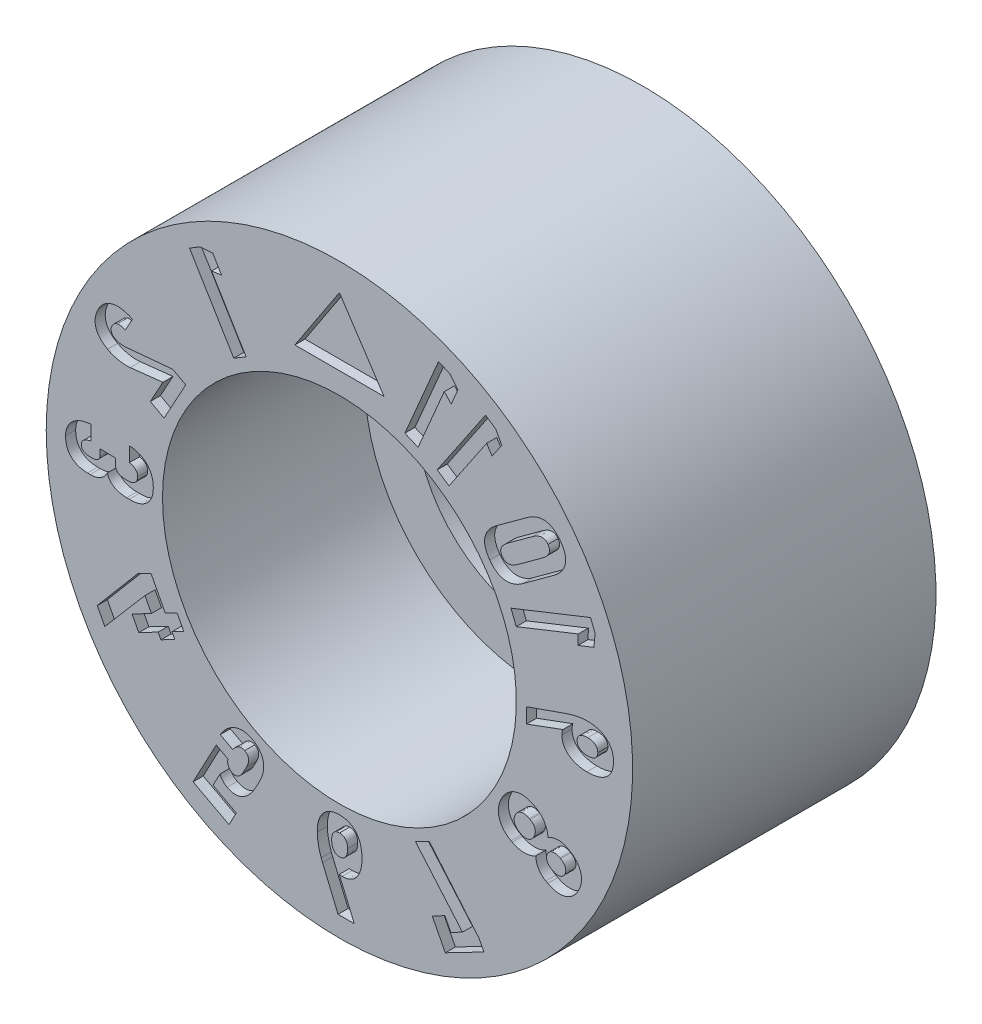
SolidWorks part; units mm, degrees
ref_plane "Front Plane" through (0, 0, 0) normal (0, 0, 1) x (1, 0, 0)
ref_plane "Top Plane" through (0, 0, 0) normal (0, 1, 0) x (1, 0, 0)
ref_plane "Right Plane" through (0, 0, 0) normal (1, 0, 0) x (0, 0, -1)
imported_body "Imported1"
other "Move Face2" parameters "D1"=0.157
other "DeleteFace1"
sketch "Sketch1" plane through (0, 0, 0) normal (0, 0, 1) x (1, 0, 0)
  line L0 (0, 0) -> (3.181, 1.8365) construction
  line L1 (0, 0) -> (3.6731, 0) construction
  line L2 (0, -1.65) -> (0, 1.65) construction
  line L3 (0, 0) -> (3.181, -1.8365) construction
  line L4 (0, 0) -> (1.8365, -3.181) construction
  line L5 (0, 0) -> (0, -3.6731) construction
  line L6 (0, 0) -> (-1.8365, -3.181) construction
  line L7 (0, 0) -> (-3.181, -1.8365) construction
  line L8 (0, 0) -> (-3.6731, 0) construction
  line L9 (0, 0) -> (-3.181, 1.8365) construction
  line L10 (0, 0) -> (-1.8365, 3.181) construction
  line L11 (0, 0) -> (0, 3.6731) construction
  line L12 (0, 0) -> (1.8365, 3.181) construction
  line L13 (1.6966, 0.7755) -> (1.7491, 0.6435)
  line L14 (1.7491, 0.6435) -> (2.362, 0.8873)
  line L15 (2.362, 0.8873) -> (2.3596, 0.7877)
  line L16 (2.3596, 0.7877) -> (2.5172, 0.8505)
  line L17 (2.5172, 0.8505) -> (2.5287, 0.976)
  line L18 (2.5287, 0.976) -> (2.4838, 1.0888)
  line L19 (2.4838, 1.0888) -> (1.6966, 0.7755)
  line L20 (1.8134, 1.0443) -> (2.1244, 1.2716)
  line L21 (1.8597, 1.6338) -> (1.5486, 1.4066)
  line L22 (1.665, 1.3166) -> (1.9102, 1.4958)
  line L23 (2.0082, 1.3617) -> (1.763, 1.1824)
  line L24 (0.9667, 1.5952) -> (1.0838, 1.5162)
  line L25 (1.0838, 1.5162) -> (1.4562, 2.0674)
  line L26 (1.4562, 2.0674) -> (1.5097, 1.9837)
  line L27 (1.5097, 1.9837) -> (1.6055, 2.1254)
  line L28 (1.6055, 2.1254) -> (1.545, 2.2357)
  line L29 (1.545, 2.2357) -> (1.445, 2.3031)
  line L30 (1.445, 2.3031) -> (0.9667, 1.5952)
  line L31 (0.6471, 1.7495) -> (0.7777, 1.6937)
  line L32 (0.7777, 1.6937) -> (1.0369, 2.3006)
  line L33 (1.0369, 2.3006) -> (1.1059, 2.2287)
  line L34 (1.1059, 2.2287) -> (1.1724, 2.3847)
  line L35 (1.1724, 2.3847) -> (1.0916, 2.4814)
  line L36 (1.0916, 2.4814) -> (0.98, 2.5291)
  line L37 (0.98, 2.5291) -> (0.6471, 1.7495)
  line L38 (-1.0449, 1.5455) -> (-0.9232, 1.6191)
  line L39 (-0.9232, 1.6191) -> (-1.2643, 2.1831)
  line L40 (-1.2643, 2.1831) -> (-1.1654, 2.1972)
  line L41 (-1.1654, 2.1972) -> (-1.253, 2.3423)
  line L42 (-1.253, 2.3423) -> (-1.3789, 2.3327)
  line L43 (-1.3789, 2.3327) -> (-1.4828, 2.2699)
  line L44 (-1.4828, 2.2699) -> (-1.0449, 1.5455)
  line L45 (-1.647, 1.149) -> (-2.109, 1.1071)
  line L46 (-2.2179, 1.1246) -> (-2.2189, 1.1252)
  line L47 (-2.1176, 1.2513) -> (-2.1171, 1.2511)
  line L48 (-2.1171, 1.2511) -> (-2.047, 1.3791)
  line L49 (-2.047, 1.3791) -> (-2.0475, 1.3793)
  line L50 (-2.2933, 0.9992) -> (-2.2929, 0.9988)
  line L51 (-2.0682, 0.9533) -> (-1.7463, 0.9887)
  line L52 (-1.7463, 0.9887) -> (-1.8703, 0.7626)
  line L53 (-1.8703, 0.7626) -> (-1.7344, 0.6881)
  line L54 (-1.7344, 0.6881) -> (-1.52, 1.0793)
  line L55 (-1.52, 1.0793) -> (-1.647, 1.149)
  line L56 (-2.0749, 0.28) -> (-2.0774, 0.1345)
  line L57 (-2.0946, -0.0277) -> (-2.1146, -0.0273)
  line L58 (-2.2145, 0.0426) -> (-2.2136, 0.1058)
  line L59 (-2.2136, 0.1058) -> (-2.3679, 0.1084)
  line L60 (-2.3679, 0.1084) -> (-2.3688, 0.0451)
  line L61 (-2.4575, -0.0096) -> (-2.4722, -0.0093)
  line L62 (-2.4577, 0.1289) -> (-2.4552, 0.2739)
  line L63 (-2.491, -0.1603) -> (-2.4653, -0.1606)
  line L64 (-2.1046, -0.1788) -> (-2.0789, -0.1793)
  line L65 (-1.9948, -0.7748) -> (-2.3951, -1.2475)
  line L66 (-2.3951, -1.2475) -> (-2.3203, -1.3904)
  line L67 (-2.3203, -1.3904) -> (-1.9233, -0.9264)
  line L68 (-1.9233, -0.9264) -> (-1.8594, -1.0482)
  line L69 (-1.7657, -1.2268) -> (-1.6285, -1.1549)
  line L70 (-1.6285, -1.1549) -> (-1.656, -1.1024)
  line L71 (-1.8638, -0.7061) -> (-1.9948, -0.7748)
  line L72 (-2.0508, -1.1485) -> (-1.9846, -1.2746)
  line L73 (-1.9846, -1.2746) -> (-1.7933, -1.1743)
  line L74 (-1.5396, -1.0414) -> (-1.6057, -0.9153)
  line L75 (-1.6057, -0.9153) -> (-1.7221, -0.9763)
  line L76 (-1.1787, -1.7448) -> (-1.179, -1.7453)
  line L77 (-1.179, -1.7453) -> (-1.0543, -1.8117)
  line L78 (-1.0543, -1.8117) -> (-1.0541, -1.8112)
  line L79 (-0.9176, -1.891) -> (-0.951, -1.9537)
  line L80 (-1.1021, -1.9164) -> (-1.2184, -1.8543)
  line L81 (-1.2184, -1.8543) -> (-1.4474, -2.284)
  line L82 (-1.4474, -2.284) -> (-1.0925, -2.4731)
  line L83 (-1.0925, -2.4731) -> (-1.0202, -2.3373)
  line L84 (-1.0202, -2.3373) -> (-1.2504, -2.2146)
  line L85 (-1.2504, -2.2146) -> (-1.18, -2.0826)
  line L86 (-0.8264, -2.0202) -> (-0.7931, -1.9575)
  line L87 (-0.2193, -2.0996) -> (-0.2193, -2.1002)
  line L88 (-0.1669, -2.3359) -> (-0.0136, -2.7018)
  line L89 (-0.0136, -2.7018) -> (0.1475, -2.7018)
  line L90 (0.1475, -2.7018) -> (-0.0017, -2.354)
  line L91 (-1.8594, -1.0482) -> (-2.0508, -1.1485)
  line L92 (0.2229, -2.1032) -> (0.2229, -2.1027)
  line L93 (0.0805, -2.0928) -> (0.0805, -2.0933)
  line L94 (-0.0769, -2.0927) -> (-0.0769, -2.092)
  line L95 (1.3802, -2.2089) -> (0.8882, -1.6259)
  line L96 (0.8882, -1.6259) -> (0.7519, -1.6967)
  line L97 (0.7519, -1.6967) -> (1.2171, -2.2394)
  line L98 (1.2171, -2.2394) -> (1.1022, -2.2989)
  line L99 (1.1022, -2.2989) -> (1.0433, -2.1852)
  line L100 (1.0433, -2.1852) -> (0.9172, -2.2505)
  line L101 (0.9172, -2.2505) -> (1.0471, -2.5013)
  line L102 (1.0471, -2.5013) -> (1.4291, -2.3034)
  line L103 (1.4291, -2.3034) -> (1.3802, -2.2089)
  line L104 (1.6972, -1.2159) -> (1.7094, -1.2227)
  line L105 (2.0407, -1.3888) -> (2.0602, -1.3996)
  line L106 (2.2751, -1.0118) -> (2.2556, -1.0011)
  line L107 (1.9393, -0.808) -> (1.9272, -0.8013)
  line L108 (1.8791, -0.9358) -> (1.8863, -0.9398)
  line L109 (1.7924, -1.1076) -> (1.7848, -1.1033)
  line L110 (2.1818, -1.1213) -> (2.189, -1.1252)
  line L111 (2.1101, -1.2661) -> (2.1024, -1.2619)
  line L112 (-1.7933, -1.1743) -> (-1.7657, -1.2268)
  line L113 (2.447, -0.2509) -> (2.4475, -0.251)
  line L114 (2.4507, 0.1867) -> (2.4501, 0.1867)
  line L115 (2.2184, 0.1374) -> (1.8524, 0.0087)
  line L116 (1.8524, 0.0087) -> (1.8503, -0.1404)
  line L117 (1.8503, -0.1404) -> (2.2091, -0.0079)
  line L118 (2.4559, 0.0457) -> (2.4564, 0.0456)
  line L119 (2.4537, -0.1102) -> (2.453, -0.1102)
  line L120 (-1.656, -1.1024) -> (-1.5396, -1.0414)
  line L121 (-1.7221, -0.9763) -> (-1.8638, -0.7061)
  circle A0 centre (0, 0) radius 1.8715 construction
  spline S0 degree 3 poles (1.4866, 1.0836) (1.4968, 1.0697) (1.5131, 1.0502) (1.5377, 1.0283) (1.556, 1.0146) (1.5753, 1.0037) (1.5951, 0.995) (1.6157, 0.9893) (1.6368, 0.9858) (1.6583, 0.9847) (1.68, 0.9863) (1.702, 0.99) (1.724, 0.9962) (1.7463, 1.0046) (1.7769, 1.0195) (1.7989, 1.0339) (1.8134, 1.0443) knots 0 0 0 0 0.13855 0.202291 0.263252 0.321822 0.378953 0.435844 0.492396 0.549808 0.607496 0.666836 0.727612 0.790784 0.857162 1 1 1 1
  spline S1 degree 3 poles (2.1244, 1.2716) (2.1388, 1.2824) (2.1594, 1.299) (2.1831, 1.3239) (2.1981, 1.3425) (2.2107, 1.3617) (2.2209, 1.3814) (2.2286, 1.4018) (2.2342, 1.4225) (2.2374, 1.4435) (2.2377, 1.4649) (2.2356, 1.4864) (2.231, 1.508) (2.2236, 1.5297) (2.21, 1.5596) (2.1967, 1.5811) (2.1864, 1.5949) knots 0 0 0 0 0.14434 0.211055 0.274351 0.335189 0.394182 0.452 0.508871 0.56551 0.621909 0.679214 0.737756 0.798535 0.861971 1 1 1 1
  spline S2 degree 3 poles (2.1864, 1.5949) (2.1761, 1.6088) (2.16, 1.6283) (2.1355, 1.6501) (2.1172, 1.6638) (2.098, 1.6749) (2.0783, 1.6835) (2.0579, 1.6894) (2.037, 1.693) (2.0156, 1.6939) (1.994, 1.6927) (1.9721, 1.6888) (1.95, 1.6827) (1.9276, 1.6741) (1.8966, 1.659) (1.8743, 1.6445) (1.8597, 1.6338) knots 0 0 0 0 0.13803 0.201717 0.262188 0.320805 0.377887 0.433794 0.490232 0.54715 0.604619 0.663499 0.724224 0.787992 0.854966 1 1 1 1
  spline S3 degree 3 poles (1.5486, 1.4066) (1.5342, 1.3958) (1.5137, 1.3791) (1.4899, 1.3543) (1.4751, 1.3355) (1.4623, 1.3164) (1.4521, 1.2965) (1.4443, 1.2762) (1.4387, 1.2555) (1.4356, 1.2344) (1.4352, 1.2131) (1.4374, 1.1917) (1.4421, 1.1702) (1.4494, 1.1486) (1.463, 1.1188) (1.4765, 1.0975) (1.4866, 1.0836) knots 0 0 0 0 0.144498 0.211286 0.274489 0.335963 0.39502 0.452901 0.509836 0.566536 0.622997 0.679941 0.738146 0.798991 0.862497 1 1 1 1
  spline S4 degree 3 poles (1.6109, 1.1744) (1.6034, 1.1845) (1.5947, 1.202) (1.5949, 1.2271) (1.6, 1.2454) (1.61, 1.2634) (1.6301, 1.2892) (1.6504, 1.3057) (1.665, 1.3166) knots 0 0 0 0 0.222006 0.32451 0.431328 0.549 0.681782 1 1 1 1
  spline S5 degree 3 poles (1.9102, 1.4958) (1.925, 1.5064) (1.947, 1.5205) (1.9776, 1.5321) (1.9979, 1.5361) (2.0168, 1.5354) (2.0408, 1.5279) (2.0547, 1.5142) (2.0622, 1.5041) knots 0 0 0 0 0.3184 0.451061 0.568569 0.675986 0.777629 1 1 1 1
  spline S6 degree 3 poles (2.0622, 1.5041) (2.0694, 1.4938) (2.0786, 1.4763) (2.0783, 1.4511) (2.0733, 1.4329) (2.0633, 1.4149) (2.043, 1.3892) (2.023, 1.3725) (2.0082, 1.3617) knots 0 0 0 0 0.222984 0.325366 0.432057 0.549589 0.681269 1 1 1 1
  spline S7 degree 3 poles (1.763, 1.1824) (1.7482, 1.1718) (1.7262, 1.1577) (1.6956, 1.1462) (1.6753, 1.1422) (1.6564, 1.1428) (1.6325, 1.1508) (1.6182, 1.1638) (1.6109, 1.1744) knots 0 0 0 0 0.318019 0.450521 0.567888 0.675177 0.776703 1 1 1 1
  spline S8 degree 3 poles (-2.109, 1.1071) (-2.1289, 1.1049) (-2.1664, 1.1061) (-2.2026, 1.1163) (-2.2179, 1.1246) knots 0 0 0 0 0.536641 1 1 1 1
  spline S9 degree 3 poles (-2.2189, 1.1252) (-2.2279, 1.1301) (-2.2403, 1.1391) (-2.2516, 1.1553) (-2.2566, 1.1681) (-2.2586, 1.1819) (-2.2571, 1.2021) (-2.2508, 1.2167) (-2.2458, 1.2263) knots 0 0 0 0 0.262423 0.377651 0.491991 0.606832 0.726643 1 1 1 1
  spline S10 degree 3 poles (-2.2458, 1.2263) (-2.2404, 1.2357) (-2.2301, 1.2489) (-2.2111, 1.2597) (-2.1952, 1.2645) (-2.1776, 1.2659) (-2.151, 1.2636) (-2.131, 1.2569) (-2.1176, 1.2513) knots 0 0 0 0 0.226717 0.335708 0.448629 0.568505 0.69917 1 1 1 1
  spline S11 degree 3 poles (-2.0475, 1.3793) (-2.0701, 1.3901) (-2.1045, 1.403) (-2.151, 1.4131) (-2.1838, 1.4161) (-2.2153, 1.4151) (-2.2452, 1.4102) (-2.2734, 1.4014) (-2.2998, 1.3889) (-2.324, 1.3724) (-2.3536, 1.345) (-2.3713, 1.32) (-2.3811, 1.3018) knots 0 0 0 0 0.196392 0.286376 0.372245 0.45426 0.532987 0.609443 0.68516 0.761271 0.838107 1 1 1 1
  spline S12 degree 3 poles (-2.3811, 1.3018) (-2.3918, 1.2826) (-2.4045, 1.2531) (-2.4144, 1.2126) (-2.4169, 1.1838) (-2.4157, 1.156) (-2.41, 1.1292) (-2.4004, 1.1036) (-2.3866, 1.0794) (-2.3689, 1.0566) (-2.3394, 1.0273) (-2.3123, 1.0098) (-2.2933, 0.9992) knots 0 0 0 0 0.183859 0.267625 0.3476 0.4249 0.500331 0.575905 0.652876 0.73298 0.816729 1 1 1 1
  spline S13 degree 3 poles (-2.2929, 0.9988) (-2.276, 0.9892) (-2.2492, 0.9777) (-2.212, 0.9656) (-2.1832, 0.959) (-2.1542, 0.954) (-2.1158, 0.9507) (-2.0871, 0.9511) (-2.0682, 0.9533) knots 0 0 0 0 0.249769 0.375644 0.503628 0.630734 0.755567 1 1 1 1
  spline S14 degree 3 poles (-1.8408, 0.0366) (-1.8407, 0.0581) (-1.843, 0.0901) (-1.8545, 0.1304) (-1.8664, 0.1581) (-1.8817, 0.1836) (-1.9004, 0.2064) (-1.9223, 0.2268) (-1.9474, 0.2442) (-1.9756, 0.2585) (-2.0177, 0.2736) (-2.0517, 0.2785) (-2.0749, 0.28) knots 0 0 0 0 0.171175 0.252045 0.331587 0.409761 0.48706 0.565351 0.646195 0.729225 0.814879 1 1 1 1
  spline S15 degree 3 poles (-2.0774, 0.1345) (-2.0692, 0.1335) (-2.0574, 0.1309) (-2.0426, 0.1255) (-2.033, 0.1204) (-2.0243, 0.1147) (-2.017, 0.1079) (-2.0104, 0.1007) (-2.0052, 0.0926) (-2.0008, 0.084) (-1.9972, 0.0713) (-1.9958, 0.0613) (-1.9962, 0.0545) knots 0 0 0 0 0.197141 0.287045 0.37243 0.455122 0.534079 0.609855 0.685692 0.761878 0.838753 1 1 1 1
  spline S16 degree 3 poles (-1.9962, 0.0545) (-1.9963, 0.0424) (-1.9992, 0.0246) (-2.0108, 0.0043) (-2.0225, -0.0076) (-2.0369, -0.0171) (-2.0608, -0.0263) (-2.0809, -0.0277) (-2.0946, -0.0277) knots 0 0 0 0 0.249611 0.363053 0.475163 0.592098 0.715272 1 1 1 1
  spline S17 degree 3 poles (-2.1146, -0.0273) (-2.1289, -0.027) (-2.1496, -0.0254) (-2.1743, -0.017) (-2.1891, -0.0091) (-2.2008, 0.0009) (-2.2118, 0.0176) (-2.2148, 0.0326) (-2.2145, 0.0426) knots 0 0 0 0 0.314551 0.447854 0.568044 0.677415 0.781407 1 1 1 1
  spline S18 degree 3 poles (-2.3688, 0.0451) (-2.3689, 0.037) (-2.3718, 0.0245) (-2.3823, 0.0114) (-2.3928, 0.0034) (-2.4059, -0.0027) (-2.4275, -0.0087) (-2.4452, -0.0099) (-2.4575, -0.0096) knots 0 0 0 0 0.211641 0.314631 0.426349 0.548472 0.682682 1 1 1 1
  spline S19 degree 3 poles (-2.4722, -0.0093) (-2.4839, -0.009) (-2.5007, -0.0074) (-2.5206, 0.0001) (-2.5325, 0.0074) (-2.5418, 0.0166) (-2.5512, 0.0314) (-2.5531, 0.0449) (-2.5529, 0.0538) knots 0 0 0 0 0.302991 0.431271 0.550649 0.660803 0.768738 1 1 1 1
  spline S20 degree 3 poles (-2.5529, 0.0538) (-2.5529, 0.0599) (-2.5513, 0.0691) (-2.5465, 0.0806) (-2.5415, 0.0886) (-2.5352, 0.096) (-2.5275, 0.1028) (-2.5187, 0.109) (-2.5086, 0.1147) (-2.4974, 0.1194) (-2.4804, 0.1247) (-2.467, 0.1278) (-2.4577, 0.1289) knots 0 0 0 0 0.139013 0.208991 0.279904 0.353459 0.429339 0.511501 0.597211 0.689683 0.786928 1 1 1 1
  spline S21 degree 3 poles (-2.4552, 0.2739) (-2.4797, 0.2723) (-2.5154, 0.2671) (-2.5601, 0.2532) (-2.59, 0.2401) (-2.6167, 0.2239) (-2.6405, 0.2054) (-2.6608, 0.1844) (-2.6778, 0.1611) (-2.6911, 0.1358) (-2.7044, 0.0996) (-2.7083, 0.0706) (-2.7085, 0.0512) knots 0 0 0 0 0.196761 0.287568 0.374557 0.457921 0.53779 0.61517 0.691851 0.768069 0.844074 1 1 1 1
  spline S22 degree 3 poles (-2.7085, 0.0512) (-2.7089, 0.0355) (-2.7077, 0.0126) (-2.702, -0.0168) (-2.6962, -0.037) (-2.6882, -0.0558) (-2.6785, -0.0731) (-2.6671, -0.0891) (-2.6538, -0.1037) (-2.6387, -0.1166) (-2.6222, -0.1281) (-2.604, -0.1376) (-2.5844, -0.1456) (-2.5632, -0.1518) (-2.5321, -0.1584) (-2.5076, -0.16) (-2.491, -0.1603) knots 0 0 0 0 0.136158 0.198953 0.259714 0.318298 0.375255 0.432148 0.488911 0.546341 0.604095 0.663326 0.724275 0.788035 0.855254 1 1 1 1
  spline S23 degree 3 poles (-2.4653, -0.1606) (-2.4468, -0.161) (-2.4194, -0.1586) (-2.385, -0.1479) (-2.362, -0.1366) (-2.3409, -0.1226) (-2.3165, -0.0993) (-2.3023, -0.078) (-2.2953, -0.0625) knots 0 0 0 0 0.26744 0.392655 0.515802 0.636085 0.755476 1 1 1 1
  spline S24 degree 3 poles (-2.2953, -0.0625) (-2.2931, -0.0713) (-2.2888, -0.0841) (-2.2805, -0.1001) (-2.273, -0.111) (-2.2647, -0.1213) (-2.255, -0.1307) (-2.2441, -0.1394) (-2.2281, -0.1503) (-2.2052, -0.1614) (-2.1629, -0.1752) (-2.1283, -0.1782) (-2.1046, -0.1788) knots 0 0 0 0 0.112296 0.167555 0.222516 0.276912 0.332264 0.389657 0.448973 0.572886 0.704345 1 1 1 1
  spline S25 degree 3 poles (-2.0789, -0.1793) (-2.0559, -0.1796) (-2.0221, -0.1777) (-1.9798, -0.1672) (-1.9519, -0.1563) (-1.9267, -0.1424) (-1.9046, -0.1253) (-1.8854, -0.1052) (-1.8697, -0.0819) (-1.8573, -0.056) (-1.8443, -0.0168) (-1.8415, 0.015) (-1.8408, 0.0366) knots 0 0 0 0 0.189684 0.275556 0.357144 0.435236 0.511027 0.585947 0.66227 0.740626 0.822133 1 1 1 1
  spline S26 degree 3 poles (-0.8657, -1.6242) (-0.8827, -1.615) (-0.9097, -1.6047) (-0.9475, -1.5992) (-0.9757, -1.5992) (-1.0039, -1.6032) (-1.0317, -1.6115) (-1.0591, -1.6239) (-1.0857, -1.6404) (-1.1112, -1.6609) (-1.1447, -1.694) (-1.1657, -1.7238) (-1.1787, -1.7448) knots 0 0 0 0 0.155454 0.230044 0.305611 0.381383 0.458304 0.53835 0.62196 0.709499 0.801167 1 1 1 1
  spline S27 degree 3 poles (-1.0541, -1.8112) (-1.0463, -1.7993) (-1.0337, -1.7831) (-1.0133, -1.7668) (-0.9981, -1.7586) (-0.9826, -1.7538) (-0.9615, -1.7521) (-0.9461, -1.757) (-0.9369, -1.7619) knots 0 0 0 0 0.302047 0.432737 0.553848 0.667016 0.776048 1 1 1 1
  spline S28 degree 3 poles (-0.9369, -1.7619) (-0.9268, -1.767) (-0.9136, -1.7778) (-0.9025, -1.7971) (-0.8984, -1.8134) (-0.8978, -1.8311) (-0.902, -1.8581) (-0.9109, -1.8777) (-0.9176, -1.891) knots 0 0 0 0 0.229162 0.336429 0.448304 0.567031 0.695976 1 1 1 1
  spline S29 degree 3 poles (-0.951, -1.9537) (-0.9581, -1.9667) (-0.9693, -1.985) (-0.9885, -2.0038) (-1.0027, -2.0135) (-1.0174, -2.0195) (-1.0376, -2.0222) (-1.0526, -2.0179) (-1.0614, -2.013) knots 0 0 0 0 0.316591 0.450244 0.57077 0.680289 0.78479 1 1 1 1
  spline S30 degree 3 poles (-1.0614, -2.013) (-1.0697, -2.0085) (-1.0815, -2.0003) (-1.0927, -1.9854) (-1.0992, -1.9734) (-1.1035, -1.9602) (-1.1059, -1.9409) (-1.1046, -1.9261) (-1.1021, -1.9164) knots 0 0 0 0 0.251131 0.370348 0.489946 0.610628 0.734779 1 1 1 1
  spline S31 degree 3 poles (-1.18, -2.0826) (-1.178, -2.0906) (-1.1731, -2.1022) (-1.1635, -2.1167) (-1.1548, -2.1276) (-1.1447, -2.1377) (-1.1307, -2.1501) (-1.1192, -2.1578) (-1.1111, -2.1622) knots 0 0 0 0 0.226998 0.349041 0.481186 0.615037 0.746292 1 1 1 1
  spline S32 degree 3 poles (-1.1111, -2.1622) (-1.095, -2.1707) (-1.0697, -2.1805) (-1.0344, -2.1845) (-1.0087, -2.183) (-0.9833, -2.177) (-0.9584, -2.167) (-0.9342, -2.1524) (-0.9105, -2.1339) (-0.8879, -2.1111) (-0.8578, -2.0741) (-0.8384, -2.0426) (-0.8264, -2.0202) knots 0 0 0 0 0.152512 0.224103 0.295317 0.367144 0.441199 0.519056 0.602305 0.691791 0.787568 1 1 1 1
  spline S33 degree 3 poles (-0.7931, -1.9575) (-0.7808, -1.9351) (-0.7661, -1.9009) (-0.7535, -1.8546) (-0.7492, -1.822) (-0.7488, -1.7908) (-0.7529, -1.7611) (-0.7613, -1.7331) (-0.7742, -1.707) (-0.7909, -1.6826) (-0.8198, -1.6525) (-0.8465, -1.6345) (-0.8657, -1.6242) knots 0 0 0 0 0.197765 0.287202 0.371545 0.451747 0.528419 0.602892 0.677462 0.753113 0.831189 1 1 1 1
  spline S34 degree 3 poles (0.0016, -1.843) (-0.0201, -1.8431) (-0.0521, -1.846) (-0.0916, -1.8591) (-0.1179, -1.8724) (-0.1415, -1.8893) (-0.1621, -1.9098) (-0.1796, -1.9338) (-0.1941, -1.9611) (-0.2055, -1.9915) (-0.2168, -2.0377) (-0.2193, -2.0744) (-0.2193, -2.0996) knots 0 0 0 0 0.169568 0.247974 0.323778 0.398716 0.473627 0.549725 0.629994 0.714308 0.802979 1 1 1 1
  spline S35 degree 3 poles (-0.2193, -2.1002) (-0.2193, -2.116) (-0.2178, -2.1402) (-0.2138, -2.1727) (-0.2044, -2.2246) (-0.1928, -2.2677) (-0.1804, -2.3013) knots 0 0 0 0 0.231046 0.352361 0.478014 1 1 1 1
  spline S36 degree 3 poles (-0.1804, -2.3013) (-0.1785, -2.3073) (-0.1737, -2.3187) (-0.1695, -2.3304) (-0.1669, -2.3359) knots 0 0 0 0 0.506984 1 1 1 1
  spline S37 degree 3 poles (-0.0017, -2.354) (0.0073, -2.3561) (0.0166, -2.3571) (0.0259, -2.3569) knots 0.765574 0.765574 0.765574 0.765574 1 1 1 1
  spline S38 degree 3 poles (0.0259, -2.3569) (0.0454, -2.3568) (0.0741, -2.3538) (0.1094, -2.3408) (0.1329, -2.3278) (0.1538, -2.3109) (0.1723, -2.2908) (0.1877, -2.267) (0.2007, -2.2401) (0.2106, -2.2099) (0.2207, -2.1642) (0.223, -2.128) (0.2229, -2.1032) knots 0 0 0 0 0.160816 0.235438 0.308609 0.381834 0.456036 0.533084 0.615132 0.702075 0.794795 1 1 1 1
  spline S39 degree 3 poles (0.2229, -2.1027) (0.2233, -2.0772) (0.2199, -2.0402) (0.2093, -1.9934) (0.1978, -1.9625) (0.1833, -1.9349) (0.1659, -1.9105) (0.1452, -1.8899) (0.1217, -1.8727) (0.0953, -1.8593) (0.0555, -1.8462) (0.0234, -1.8429) (0.0016, -1.843) knots 0 0 0 0 0.197364 0.286561 0.371072 0.451521 0.527764 0.602421 0.67669 0.75252 0.830754 1 1 1 1
  spline S40 degree 3 poles (0.0016, -1.9973) (0.013, -1.9973) (0.0299, -1.9998) (0.0491, -2.0109) (0.0607, -2.022) (0.0699, -2.036) (0.0784, -2.0595) (0.0808, -2.0791) (0.0805, -2.0928) knots 0 0 0 0 0.244404 0.355383 0.46783 0.584389 0.708441 1 1 1 1
  spline S41 degree 3 poles (0.0805, -2.0933) (0.0808, -2.1089) (0.0785, -2.1313) (0.0699, -2.1583) (0.0609, -2.1744) (0.0493, -2.187) (0.0303, -2.1995) (0.013, -2.2027) (0.0015, -2.2026) knots 0 0 0 0 0.308363 0.43778 0.556928 0.667128 0.773071 1 1 1 1
  spline S42 degree 3 poles (0.0015, -2.2026) (-0.0099, -2.2028) (-0.0269, -2.1993) (-0.0457, -2.1866) (-0.0571, -2.1736) (-0.0661, -2.1575) (-0.075, -2.1305) (-0.0771, -2.1083) (-0.0769, -2.0927) knots 0 0 0 0 0.225579 0.33143 0.442785 0.563178 0.693236 1 1 1 1
  spline S43 degree 3 poles (-0.0769, -2.092) (-0.0771, -2.0785) (-0.075, -2.0589) (-0.066, -2.0356) (-0.0569, -2.0217) (-0.0454, -2.0107) (-0.0266, -1.9995) (-0.0096, -1.9975) (0.0016, -1.9973) knots 0 0 0 0 0.292539 0.416819 0.534256 0.645794 0.756534 1 1 1 1
  spline S44 degree 3 poles (1.6066, -0.8945) (1.5959, -0.9141) (1.5825, -0.9445) (1.5733, -0.9867) (1.5708, -1.0173) (1.5725, -1.0473) (1.5784, -1.0765) (1.5885, -1.1043) (1.6028, -1.1307) (1.6209, -1.1555) (1.6506, -1.1865) (1.6778, -1.2052) (1.6972, -1.2159) knots 0 0 0 0 0.178576 0.261915 0.343211 0.422933 0.501003 0.579098 0.658436 0.739675 0.822465 1 1 1 1
  spline S45 degree 3 poles (1.7094, -1.2227) (1.7274, -1.2329) (1.7565, -1.2444) (1.7974, -1.2523) (1.8286, -1.254) (1.8594, -1.2524) (1.8987, -1.2448) (1.9259, -1.2328) (1.9424, -1.2225) knots 0 0 0 0 0.255039 0.381663 0.510512 0.638243 0.760492 1 1 1 1
  spline S46 degree 3 poles (1.9424, -1.2225) (1.9424, -1.2391) (1.9459, -1.2641) (1.9572, -1.2958) (1.9689, -1.3187) (1.9831, -1.3402) (2.0058, -1.3654) (2.0259, -1.3808) (2.0407, -1.3888) knots 0 0 0 0 0.246426 0.370953 0.498244 0.626832 0.75121 1 1 1 1
  spline S47 degree 3 poles (2.0602, -1.3996) (2.0784, -1.4099) (2.107, -1.4218) (2.1465, -1.4306) (2.1754, -1.4326) (2.2036, -1.4308) (2.231, -1.4256) (2.257, -1.4157) (2.282, -1.4025) (2.3052, -1.3855) (2.3344, -1.3575) (2.3518, -1.3319) (2.3621, -1.3137) knots 0 0 0 0 0.177802 0.260988 0.342749 0.42235 0.500364 0.578414 0.657995 0.739077 0.822225 1 1 1 1
  spline S48 degree 3 poles (2.3621, -1.3137) (2.3721, -1.2953) (2.3847, -1.2669) (2.3928, -1.2273) (2.3951, -1.1986) (2.3931, -1.1704) (2.3876, -1.1431) (2.3778, -1.1169) (2.3643, -1.092) (2.3471, -1.0687) (2.3188, -1.0397) (2.2935, -1.0218) (2.2751, -1.0118) knots 0 0 0 0 0.17763 0.260766 0.342067 0.421374 0.499616 0.577605 0.657581 0.739126 0.822311 1 1 1 1
  spline S49 degree 3 poles (2.2556, -1.0011) (2.2408, -0.9926) (2.2168, -0.9834) (2.1831, -0.9777) (2.1573, -0.9771) (2.1317, -0.9795) (2.0988, -0.9874) (2.0758, -0.998) (2.0619, -1.0072) knots 0 0 0 0 0.251411 0.375129 0.502934 0.630165 0.754068 1 1 1 1
  spline S50 degree 3 poles (2.0619, -1.0072) (2.0618, -0.9875) (2.0575, -0.9577) (2.0431, -0.9201) (2.0287, -0.8927) (2.0108, -0.8671) (1.9827, -0.8365) (1.9575, -0.8179) (1.9393, -0.808) knots 0 0 0 0 0.241508 0.364216 0.491952 0.620259 0.746307 1 1 1 1
  spline S51 degree 3 poles (1.9272, -0.8013) (1.9078, -0.7904) (1.8775, -0.7775) (1.8356, -0.7685) (1.805, -0.7661) (1.7751, -0.7682) (1.7461, -0.7743) (1.7183, -0.7845) (1.6919, -0.799) (1.6671, -0.8173) (1.6362, -0.8476) (1.6173, -0.8748) (1.6066, -0.8945) knots 0 0 0 0 0.177202 0.260211 0.341225 0.420501 0.498834 0.576376 0.656136 0.73786 0.821283 1 1 1 1
  spline S52 degree 3 poles (1.7409, -0.969) (1.7452, -0.9612) (1.7529, -0.9501) (1.766, -0.9384) (1.7765, -0.9312) (1.7879, -0.9258) (1.7999, -0.922) (1.8126, -0.9199) (1.8257, -0.9195) (1.839, -0.9211) (1.8574, -0.9253) (1.8706, -0.9312) (1.8791, -0.9358) knots 0 0 0 0 0.169065 0.249448 0.328653 0.407188 0.485543 0.565266 0.64689 0.731038 0.816893 1 1 1 1
  spline S53 degree 3 poles (1.8863, -0.9398) (1.8942, -0.9441) (1.9051, -0.9518) (1.9172, -0.9643) (1.9244, -0.9743) (1.9302, -0.9851) (1.9341, -0.9965) (1.9367, -1.0082) (1.9375, -1.0204) (1.9366, -1.0328) (1.9329, -1.05) (1.9275, -1.0623) (1.9232, -1.0702) knots 0 0 0 0 0.177477 0.25989 0.340723 0.420424 0.499507 0.576742 0.656507 0.737833 0.821366 1 1 1 1
  spline S54 degree 3 poles (1.9232, -1.0702) (1.9189, -1.0782) (1.911, -1.089) (1.8987, -1.1013) (1.8886, -1.1086) (1.8779, -1.1145) (1.8665, -1.1187) (1.8546, -1.1211) (1.8423, -1.1217) (1.8298, -1.1209) (1.8126, -1.1171) (1.8003, -1.112) (1.7924, -1.1076) knots 0 0 0 0 0.176816 0.260267 0.3408 0.42013 0.498683 0.577081 0.657086 0.73969 0.822912 1 1 1 1
  spline S55 degree 3 poles (1.7848, -1.1033) (1.7764, -1.0985) (1.7644, -1.0906) (1.7514, -1.0771) (1.7431, -1.0666) (1.7365, -1.0554) (1.7317, -1.0437) (1.7287, -1.0315) (1.7274, -1.0191) (1.7279, -1.0064) (1.7313, -0.9892) (1.7364, -0.9768) (1.7409, -0.969) knots 0 0 0 0 0.182979 0.268966 0.353384 0.434107 0.513704 0.591639 0.670643 0.749888 0.830139 1 1 1 1
  spline S56 degree 3 poles (2.0586, -1.1453) (2.0624, -1.1386) (2.069, -1.1293) (2.0803, -1.1194) (2.0896, -1.1137) (2.0996, -1.1093) (2.1102, -1.1064) (2.1214, -1.1053) (2.1331, -1.1053) (2.1452, -1.1071) (2.1618, -1.1115) (2.174, -1.1169) (2.1818, -1.1213) knots 0 0 0 0 0.162951 0.240075 0.317443 0.394381 0.47131 0.550403 0.633195 0.719519 0.809 1 1 1 1
  spline S57 degree 3 poles (2.189, -1.1252) (2.1963, -1.1293) (2.2066, -1.1363) (2.2182, -1.1474) (2.2251, -1.1564) (2.2309, -1.1658) (2.235, -1.1758) (2.2377, -1.186) (2.2388, -1.1966) (2.2387, -1.2073) (2.2358, -1.2219) (2.2317, -1.2325) (2.2278, -1.2391) knots 0 0 0 0 0.186943 0.272539 0.356134 0.43798 0.51576 0.593414 0.671204 0.750648 0.830297 1 1 1 1
  spline S58 degree 3 poles (2.2278, -1.2391) (2.2241, -1.2458) (2.2175, -1.255) (2.2065, -1.2649) (2.1975, -1.2708) (2.1881, -1.2757) (2.1779, -1.2785) (2.1673, -1.2803) (2.1561, -1.2804) (2.1447, -1.2792) (2.1289, -1.2753) (2.1175, -1.27) (2.1101, -1.2661) knots 0 0 0 0 0.168017 0.248325 0.326166 0.40434 0.481076 0.559954 0.641758 0.726213 0.813696 1 1 1 1
  spline S59 degree 3 poles (2.1024, -1.2619) (2.0946, -1.2577) (2.084, -1.2502) (2.0715, -1.2386) (2.064, -1.2293) (2.0577, -1.2196) (2.0529, -1.2095) (2.05, -1.1989) (2.0483, -1.1881) (2.0483, -1.1772) (2.0505, -1.1624) (2.0549, -1.1519) (2.0586, -1.1453) knots 0 0 0 0 0.189424 0.277747 0.363934 0.44569 0.525577 0.602818 0.681045 0.758375 0.836564 1 1 1 1
  spline S60 degree 3 poles (2.2091, -0.0079) (2.2089, -0.0086) (2.2069, -0.0141) (2.2022, -0.0304) (2.201, -0.0467) (2.2005, -0.0578) knots 0.574399 0.574399 0.574399 0.574399 0.593165 0.721856 1 1 1 1
  spline S61 degree 3 poles (2.2005, -0.0578) (2.2001, -0.0758) (2.2037, -0.1024) (2.2163, -0.1356) (2.2297, -0.1581) (2.2466, -0.1788) (2.2668, -0.1972) (2.2904, -0.2128) (2.3169, -0.2261) (2.3461, -0.2369) (2.3894, -0.2477) (2.4237, -0.2505) (2.447, -0.2509) knots 0 0 0 0 0.153541 0.22729 0.301847 0.377495 0.454537 0.534698 0.618878 0.707601 0.800232 1 1 1 1
  spline S62 degree 3 poles (2.4475, -0.251) (2.4731, -0.2514) (2.5104, -0.2491) (2.5575, -0.2387) (2.5885, -0.2279) (2.6165, -0.2141) (2.641, -0.1971) (2.6621, -0.177) (2.6794, -0.1538) (2.6932, -0.1279) (2.7069, -0.0888) (2.7102, -0.057) (2.7107, -0.0354) knots 0 0 0 0 0.19903 0.288812 0.373732 0.454023 0.530394 0.604956 0.679285 0.754534 0.831869 1 1 1 1
  spline S63 degree 3 poles (2.7107, -0.0354) (2.7107, -0.014) (2.7083, 0.0178) (2.6952, 0.057) (2.682, 0.0833) (2.6649, 0.1068) (2.6441, 0.1276) (2.6197, 0.1452) (2.5919, 0.16) (2.561, 0.1717) (2.5138, 0.1829) (2.4765, 0.1866) (2.4507, 0.1867) knots 0 0 0 0 0.166234 0.24371 0.318902 0.393187 0.467795 0.544907 0.625457 0.710691 0.800374 1 1 1 1
  spline S64 degree 3 poles (2.4501, 0.1867) (2.4353, 0.1872) (2.4126, 0.1854) (2.3817, 0.1819) (2.3573, 0.1773) (2.332, 0.1718) (2.2963, 0.1624) (2.2691, 0.1543) (2.2507, 0.1483) knots 0 0 0 0 0.218165 0.334923 0.456361 0.583261 0.7158 1 1 1 1
  spline S65 degree 3 poles (2.2507, 0.1483) (2.2452, 0.1467) (2.2344, 0.1431) (2.2236, 0.1395) (2.2184, 0.1374) knots 0 0 0 0 0.505381 1 1 1 1
  spline S66 degree 3 poles (2.3506, -0.0305) (2.3505, -0.0192) (2.354, -0.0025) (2.3662, 0.016) (2.3785, 0.0273) (2.394, 0.0359) (2.4197, 0.0444) (2.4411, 0.0457) (2.4559, 0.0457) knots 0 0 0 0 0.230076 0.337176 0.449029 0.567652 0.697238 1 1 1 1
  spline S67 degree 3 poles (2.4564, 0.0456) (2.4706, 0.0452) (2.4913, 0.0436) (2.5156, 0.0341) (2.5302, 0.025) (2.5415, 0.0134) (2.5529, -0.0054) (2.5552, -0.0222) (2.5552, -0.0333) knots 0 0 0 0 0.300028 0.42754 0.544829 0.656112 0.764919 1 1 1 1
  spline S68 degree 3 poles (2.5552, -0.0333) (2.5549, -0.0446) (2.5524, -0.0617) (2.5401, -0.0802) (2.5282, -0.0915) (2.5133, -0.1001) (2.4886, -0.1088) (2.468, -0.1104) (2.4537, -0.1102) knots 0 0 0 0 0.237167 0.345643 0.457878 0.575652 0.702043 1 1 1 1
  spline S69 degree 3 poles (2.453, -0.1102) (2.4383, -0.11) (2.4171, -0.1077) (2.3917, -0.0987) (2.3766, -0.0894) (2.3648, -0.0778) (2.3529, -0.0589) (2.3506, -0.0417) (2.3506, -0.0305) knots 0 0 0 0 0.302062 0.430434 0.549438 0.659633 0.766986 1 1 1 1
  point P21 (0, 0)
  dimension "D1" = 3.743
  dimension "D2" = 12
  dimension "D3" = 60
extrude "Cut-Extrude1" cut sketch "Sketch1" against normal blind 0.1
